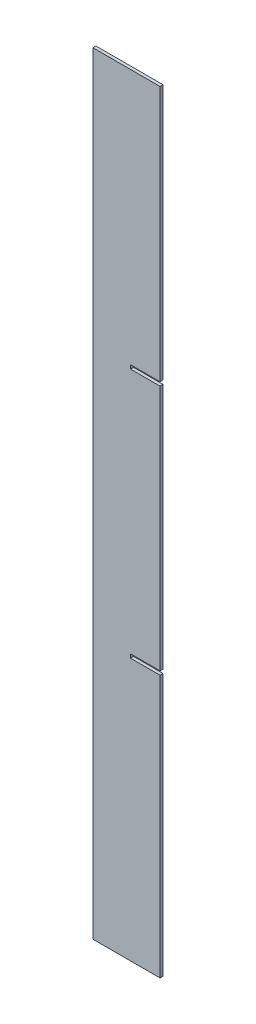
SolidWorks part; units mm, degrees
ref_plane "Спереди" through (0, 0, 0) normal (0, 0, 1) x (1, 0, 0)
ref_plane "Сверху" through (0, 0, 0) normal (0, 1, 0) x (1, 0, 0)
ref_plane "Справа" through (0, 0, 0) normal (1, 0, 0) x (0, 0, -1)
sketch "Model" plane through (0, 0, 0) normal (0, 0, 1) x (1, 0, 0)
  line L0 (-4475.8372, 581.037) -> (-4475.8372, 583.037)
  line L1 (-4475.8372, 583.037) -> (-4475.8372, 583.2869)
  line L2 (-4475.8372, 583.2869) -> (-4456.129, 583.2869)
  line L3 (-4456.129, 583.2869) -> (-4456.129, 753.8775)
  line L4 (-4456.129, 753.8775) -> (-4500.8945, 753.8775)
  line L5 (-4500.8945, 753.8775) -> (-4500.8946, 238.8775)
  line L6 (-4500.8946, 238.8775) -> (-4456.1291, 238.8775)
  line L7 (-4456.1291, 238.8775) -> (-4456.129, 413.787)
  line L8 (-4456.129, 413.787) -> (-4475.8372, 413.787)
  line L9 (-4475.8372, 413.787) -> (-4475.8372, 414.0371)
  line L10 (-4475.8372, 414.0371) -> (-4475.8372, 416.0371)
  line L11 (-4475.8372, 416.0371) -> (-4475.8372, 416.287)
  line L12 (-4475.8372, 416.287) -> (-4456.129, 416.287)
  line L13 (-4456.129, 416.287) -> (-4456.129, 580.7869)
  line L14 (-4456.129, 580.7869) -> (-4475.8372, 580.7869)
  line L15 (-4475.8372, 580.7869) -> (-4475.8372, 581.037)
extrude "Бобышка-Вытянуть1" add sketch "Model" along normal blind 2
